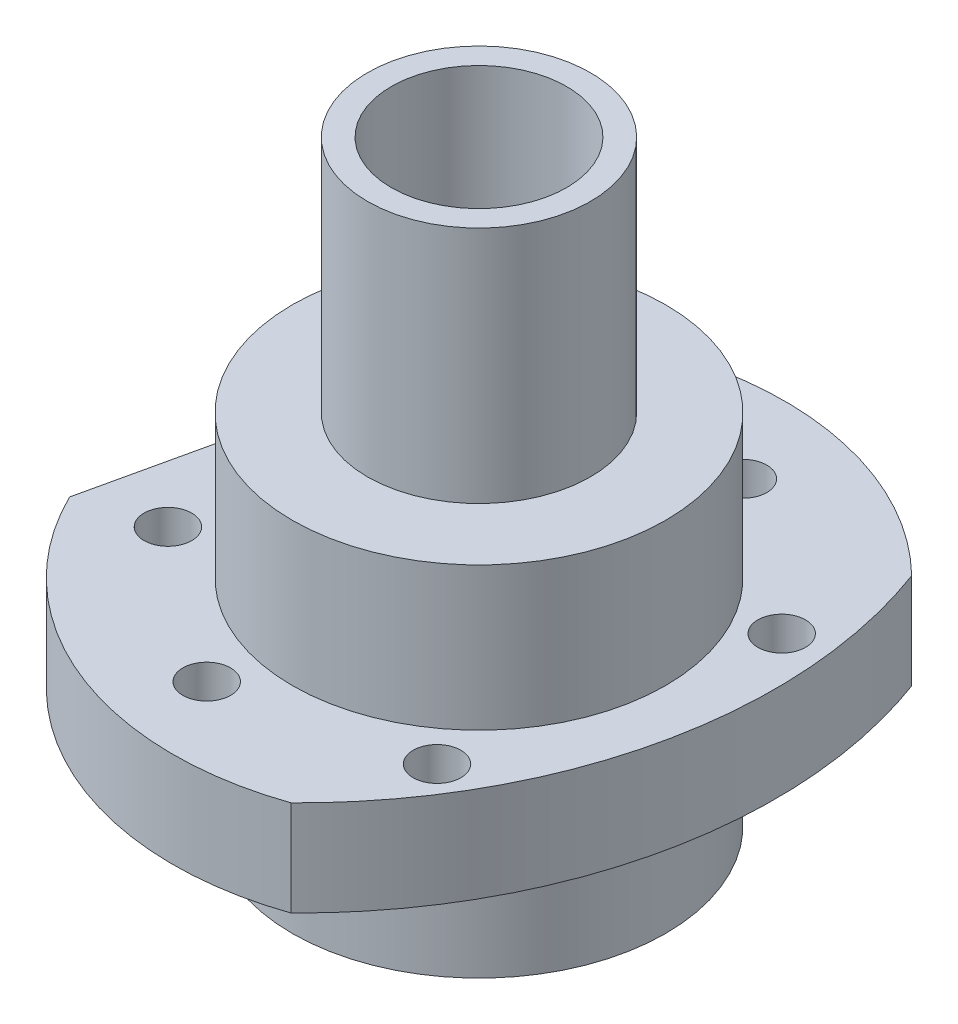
SolidWorks part; units mm, degrees
ref_plane "Front Plane" through (0, 0, 0) normal (0, 0, 1) x (1, 0, 0)
ref_plane "Top Plane" through (0, 0, 0) normal (0, 1, 0) x (1, 0, 0)
ref_plane "Right Plane" through (0, 0, 0) normal (1, 0, 0) x (0, 0, -1)
sketch "Sketch1" plane through (0, 0, 0) normal (1, 0, 0) x (0, 0, -1)
  line L0 (13, 0) -> (16, 0)
  line L4 (16, 30) -> (9.7, 30)
  line L5 (0.35, 30) -> (0.35, 0) construction
  line L6 (13, 0) -> (13, 2)
  line L7 (7.7, 30) -> (7.7, 50)
  line L8 (7.7, 50) -> (9.7, 50)
  line L9 (9.7, 50) -> (9.7, 30)
  line L10 (7.7, 30) -> (7.7, 27)
  line L11 (7.7, 27) -> (13, 27)
  line L15 (13, 23) -> (13, 27)
  line L16 (16, 0) -> (16, 10)
  line L17 (16, 10) -> (26, 10)
  line L19 (26, 18) -> (16, 18)
  line L20 (16, 18) -> (16, 30)
  line L21 (26, 18) -> (26, 10)
  line L22 (13, 2) -> (13.3, 2)
  line L23 (14, 2.7) -> (14, 4.3)
  line L24 (13.3, 5) -> (13, 5)
  line L25 (13, 5) -> (13, 23)
  arc A2 (14, 4.3) -> (13.3, 5) centre (13.3, 4.3) ccw
  arc A3 (13.3, 2) -> (14, 2.7) centre (13.3, 2.7) ccw
  dimension "D13" = 3
  dimension "D11" = 0.7
  dimension "D1" = 12.65
  dimension "D2" = 10
  dimension "D3" = 10
  dimension "D4" = 30
  dimension "D5" = 2
  dimension "D6" = 7.35
  dimension "D7" = 2
  dimension "D8" = 20
  dimension "D9" = 3
  dimension "D10" = 1
  dimension "D12" = 27
  dimension "D14" = 3
  dimension "D15" = 3
  dimension "D16" = 8
revolve "Revolve1" add sketch "Sketch1" angle 360 about L5
sketch "Sketch2" plane through (0, 18, 0) normal (0, 1, 0) x (1, 0, 0)
  line L0 (-10.7648, 43.7564) -> (-28.2663, -34.3057) construction
  line L1 (-16.0021, 20.3963) -> (-23.029, -10.9456)
  arc A0 (8.4594, -23.8649) -> (17.9879, 18.6354) centre (0, 0.35) ccw
  circle A1 centre (0, 0.35) radius 25.65
  arc A2 (-16.0021, 20.3963) -> (-23.029, -10.9456) centre (0, 0.35) ccw
  spline S0 degree 3 poles (-282.9538, -1001.2843) (-57.8138, -14.3938) (-43.9309, -31.2239) (-26.9847, -34.5728) (-26.3409, -34.6899) (-25.6953, -34.7962) (-25.0478, -34.892) (-23.9662, -35.034) (-22.4457, -35.1833) (-20.484, -35.2789) (-18.5198, -35.2783) (-15.9048, -35.1489) (-12.6525, -34.7468) (-8.8168, -33.884) (-5.0839, -32.6494) (-1.49, -31.0549) (1.9303, -29.1158) (5.144, -26.8508) (8.1203, -24.2817) (10.8304, -21.4332) (13.2483, -18.3328) (15.3506, -15.0104) (17.1172, -11.4979) (18.5309, -7.8291) (19.5783, -4.0394) (20.2491, -0.1654) (20.537, 3.7558) (20.4392, 7.6863) (19.9566, 11.5883) (19.0938, 15.4242) (17.8593, 19.1571) (16.2647, 22.7509) (14.3256, 26.1712) (12.0606, 29.385) (9.4915, 32.3612) (6.643, 35.0713) (3.5428, 37.4892) (0.7735, 39.2414) (-1.536, 40.4749) (-3.3119, 41.314) (-5.1266, 42.065) (-6.6681, 42.6159) (-7.9161, 43.0109) (-8.8591, 43.2837) (-28.1957, 48.4015) (-51.5886, 35.5628) (171.0723, 1027.0596) knots -0.396867 -0.396867 -0.396867 -0.396867 0.005212 0.010422 0.01563 0.020838 0.026048 0.03126 0.046889 0.062518 0.078147 0.093775 0.125023 0.156271 0.187519 0.218768 0.250016 0.281264 0.312512 0.34376 0.375008 0.406256 0.437504 0.468752 0.5 0.531248 0.562496 0.593744 0.624993 0.656241 0.687489 0.718737 0.749985 0.781233 0.812481 0.843729 0.874977 0.906225 0.921854 0.937483 0.953111 0.96874 0.976557 0.98437 0.992183 1.454168 1.454168 1.454168 1.454168 only from (-28.2663, -34.3057) to (-10.7648, 43.7564) construction
  spline S1 degree 3 poles (8.4594, -23.8649) (9.268, -23.0737) (10.9398, -21.2929) (13.2483, -18.3328) (15.3506, -15.0104) (17.1172, -11.4979) (18.5309, -7.8291) (19.5783, -4.0394) (20.2491, -0.1654) (20.537, 3.7558) (20.4392, 7.6863) (19.9566, 11.5883) (19.1329, 15.2506) (18.3814, 17.5747) (17.9879, 18.6354) knots 0.316753 0.316753 0.316753 0.316753 0.34376 0.375008 0.406256 0.437504 0.468752 0.5 0.531248 0.562496 0.593744 0.624993 0.656241 0.683248 0.683248 0.683248 0.683248
  dimension "D1" = 0
extrude "Cut-Extrude1" cut sketch "Sketch2" against normal blind 8
sketch "Sketch3" plane through (0, 18, 0) normal (0, 1, 0) x (1, 0, 0)
  line L0 (-11.7583, 14.9246) -> (11.7583, -14.9246) construction
  line L1 (-16.7397, -8.988) -> (16.7397, 8.988) construction
  line L2 (-3.8748, -18.6007) -> (3.8748, 18.6007) construction
  circle A0 centre (-11.7583, 14.9246) radius 2
  circle A1 centre (-16.7397, -8.988) radius 2
  circle A2 centre (-3.8748, -18.6007) radius 2
  circle A3 centre (11.7583, -14.9246) radius 2
  circle A4 centre (16.7397, 8.988) radius 2
  circle A5 centre (3.8748, 18.6007) radius 2
  point P12 (0, 0)
  point P13 (0, 0)
  point P15 (0, 0)
  dimension "D1" = 4
  dimension "D2" = 38
  dimension "D3" = 50
  dimension "D4" = 80
extrude "Cut-Extrude2" cut sketch "Sketch3" against normal blind 8
